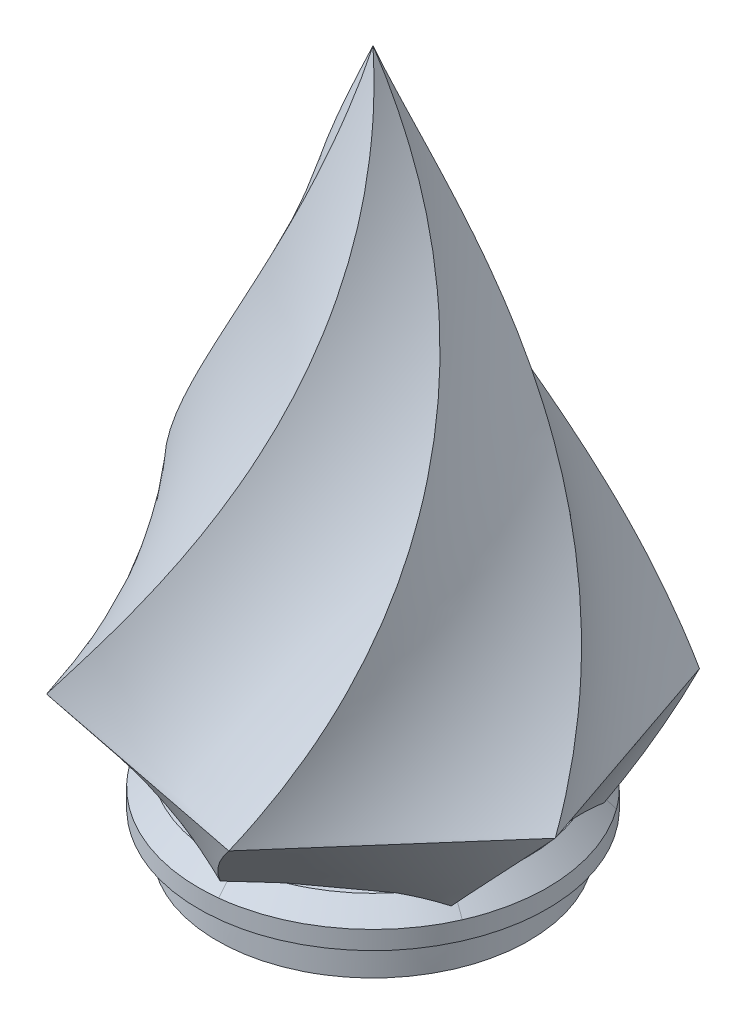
SolidWorks part; units mm, degrees
ref_plane "Front Plane" through (0, 0, 0) normal (0, 0, 1) x (1, 0, 0)
ref_plane "Top Plane" through (0, 0, 0) normal (0, 1, 0) x (1, 0, 0)
ref_plane "Right Plane" through (0, 0, 0) normal (1, 0, 0) x (0, 0, -1)
sketch "Sketch1" plane through (0, 0, 0) normal (0, 1, 0) x (1, 0, 0)
  circle A0 centre (0, 0) radius 8.5
extrude "Boss-Extrude1" add sketch "Sketch1" along normal blind 2
sketch "Sketch2" plane through (0, 2, 0) normal (0, 1, 0) x (1, 0, 0)
  circle A0 centre (0, 0) radius 9.5
extrude "Boss-Extrude2" add sketch "Sketch2" along normal blind 2
sketch "Sketch3" plane through (0, 4, 0) normal (0, 1, 0) x (1, 0, 0)
  line L1 (9.5, 0) -> (4.75, 8.2272)
  line L2 (4.75, 8.2272) -> (-4.75, 8.2272)
  line L3 (-4.75, 8.2272) -> (-9.5, 0)
  line L4 (-9.5, 0) -> (-4.75, -8.2272)
  line L5 (-4.75, -8.2272) -> (4.75, -8.2272)
  line L6 (4.75, -8.2272) -> (9.5, 0)
  circle A0 centre (0, 0) radius 8.2272 construction
extrude "Boss-Extrude3" add sketch "Sketch3" along normal blind 4 draft 34
sketch "Sketch4" plane through (0, 8, 0) normal (0, 1, 0) x (1, 0, 0)
  line L1 (12.6154, 0) -> (6.3077, 10.9253)
  line L2 (6.3077, 10.9253) -> (-6.3077, 10.9253)
  line L3 (-6.3077, 10.9253) -> (-12.6154, 0)
  line L4 (-12.6154, 0) -> (-6.3077, -10.9253)
  line L5 (-6.3077, -10.9253) -> (6.3077, -10.9253)
  line L6 (6.3077, -10.9253) -> (12.6154, 0)
  circle A0 centre (0, 0) radius 10.9253 construction
extrude "Boss-Extrude4" add sketch "Sketch4" along normal blind 30 draft 20
other "Flex1" parameters "D0"=120, "D1"=0, "D2"=0
chamfer "Chamfer1" distance 1 angle 45 6 edges at (-2.9184, 4, 9.0394) (9.2753, 4, -2.0539) (6.3962, 4, 7.0236) (2.8974, 4, -9.0472) (-6.3886, 4, -7.0328) (-9.2901, 4, 1.9851)
